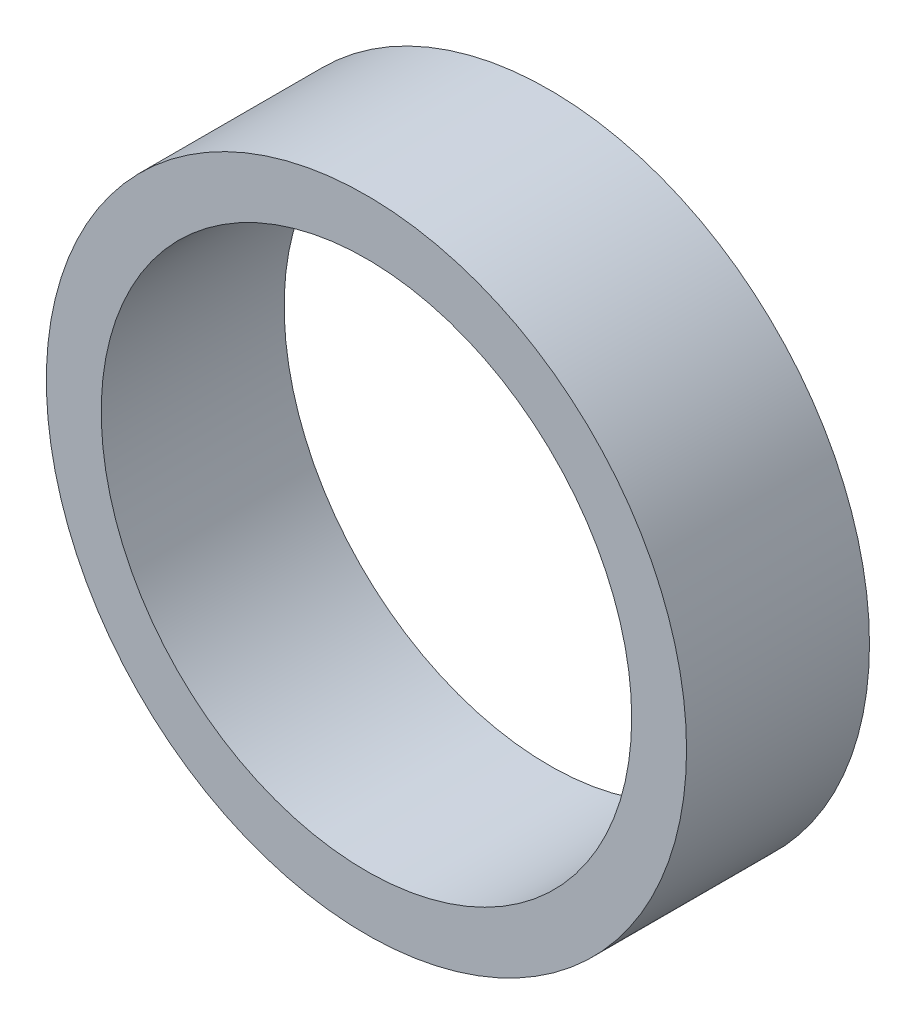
SolidWorks part; units mm, degrees
ref_plane "Plane1" through (0, 0, 0) normal (0, 0, 1) x (1, 0, 0)
ref_plane "Plane2" through (0, 0, 0) normal (0, 1, 0) x (1, 0, 0)
ref_plane "Plane3" through (0, 0, 0) normal (1, 0, 0) x (0, 0, -1)
other "Configuration Table"
sketch "Sketch1" plane through (0, 0, 0) normal (0, 0, 1) x (1, 0, 0)
  circle A0 centre (0, 0) radius 36.83
  circle A1 centre (0, 0) radius 44.45
extrude "BasePipeXS" add sketch "Sketch1" along normal mid plane 25.4
